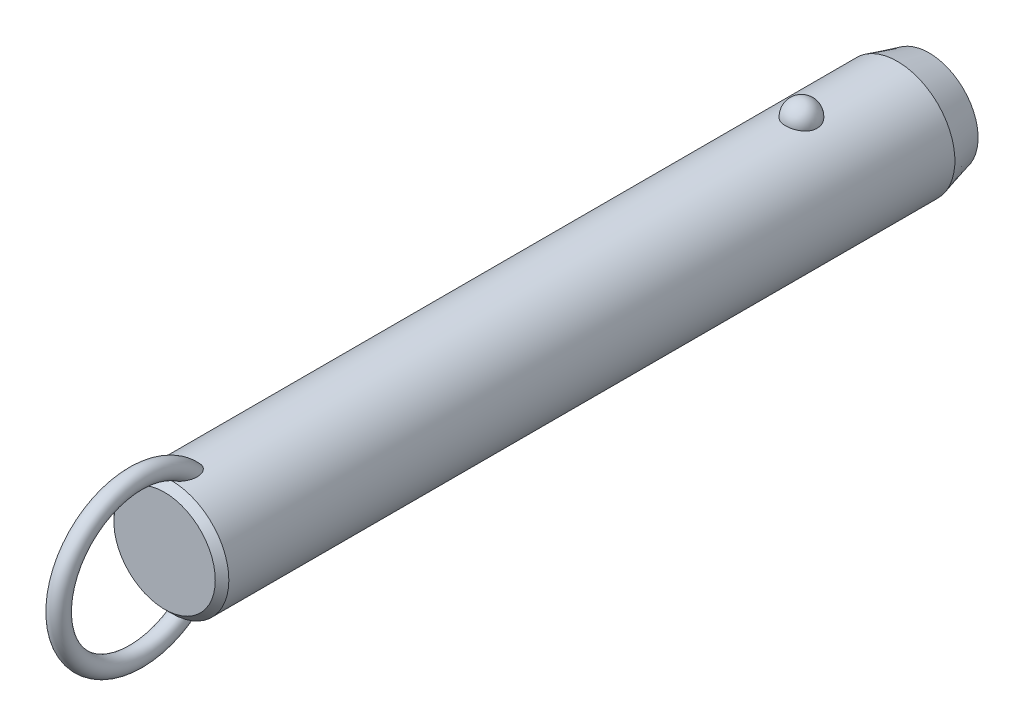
SolidWorks part; units mm, degrees
ref_plane "Front Plane" through (0, 0, 0) normal (0, 0, 1) x (1, 0, 0)
ref_plane "Top Plane" through (0, 0, 0) normal (0, 1, 0) x (1, 0, 0)
ref_plane "Right Plane" through (0, 0, 0) normal (1, 0, 0) x (0, 0, -1)
sketch "Sketch2" plane through (0, 0, 0) normal (0, 0, 1) x (1, 0, 0)
  circle A0 centre (0, 0) radius 12.7
  point P3 (0, 12.7)
  dimension "D1" = 25.4
extrude "Boss-Extrude1" add sketch "Sketch2" along normal blind 124.5
sketch "Sketch3" plane through (0, 0, 0) normal (0, 0, -1) x (-1, 0, 0)
  circle A0 centre (0, 0) radius 12.7
  dimension "D1" = 25.4
extrude "Boss-Extrude2" add sketch "Sketch3" along normal blind 31.7
chamfer "Chamfer1" distance 7 angle 15 1 edges at (-12.7, 0, -31.7)
sketch "Sketch12" plane through (0, 0, 0) normal (1, 0, 0) x (0, 0, -1)
  line L0 (-124.5, 12.7) -> (-124.5, -12.7) construction
  point P0 (-124.5, 0)
sketch "Sketch13" plane through (0, 0, 0) normal (1, 0, 0) x (0, 0, -1)
  circle A0 centre (-143.55, 0) radius 19.05
  point P2 (-124.5, 0)
  dimension "D1" = 38.1
sketch "Sketch14" plane through (0, 0, 0) normal (0, 1, 0) x (1, 0, 0)
  circle A0 centre (0, -126.5) radius 2
  point P2 (0, -124.5)
  dimension "D1" = 4
sweep "Sweep1" add profiles "Sketch14" path "Sketch13"
sketch "Sketch15" plane through (0, 0, 124.5) normal (0, 0, 1) x (1, 0, 0)
  circle A0 centre (0, 0) radius 12.7
  dimension "D1" = 25.4
extrude "Boss-Extrude3" add sketch "Sketch15" along normal blind 12.7
chamfer "Chamfer2" distance 1.5 angle 45 1 edges at (12.7, 0, 137.2)
sketch "Sketch18" plane through (0, 0, 0) normal (1, 0, 0) x (0, 0, -1)
  line L0 (24.7, 12.7) -> (-129.351, 12.7) construction
  line L1 (3.5, 16.2) -> (3.5, 9.2)
  line L2 (-129.351, -12.7) -> (24.7, -12.7) construction
  arc A0 (3.5, 16.2) -> (3.5, 9.2) centre (3.5, 12.7) ccw
  point P4 (0, 12.7)
  dimension "D1" = 28.9
revolve "Revolve1" add sketch "Sketch18" angle 360 about L1
